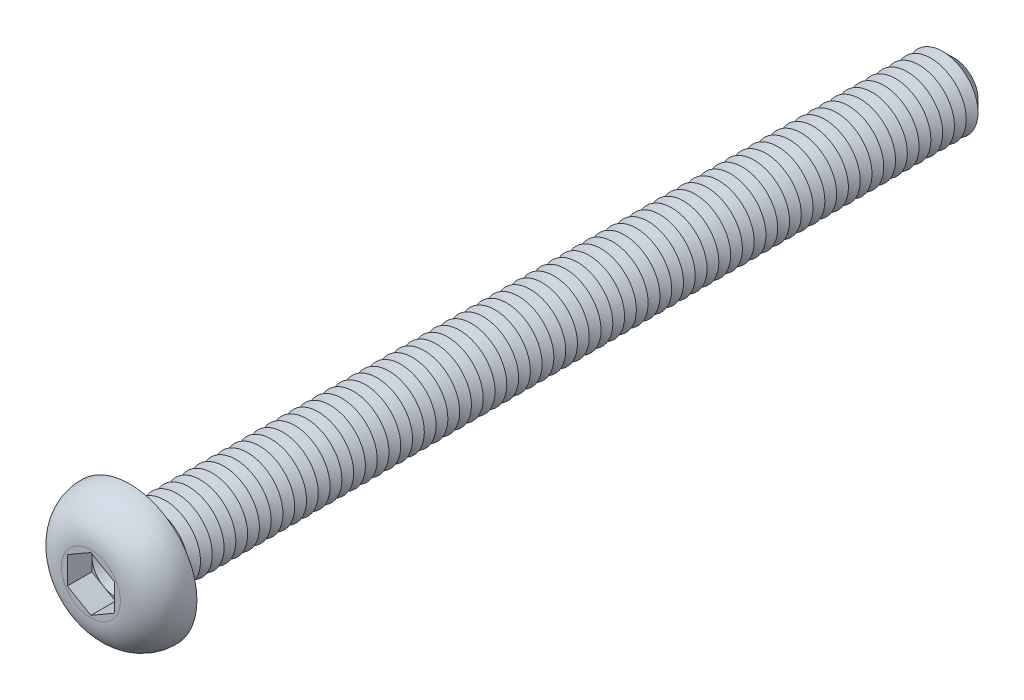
SolidWorks part; units mm, degrees
ref_plane "Front Plane" through (0, 0, 0) normal (0, 0, 1) x (1, 0, 0)
ref_plane "Top Plane" through (0, 0, 0) normal (0, 1, 0) x (1, 0, 0)
ref_plane "Right Plane" through (0, 0, 0) normal (1, 0, 0) x (0, 0, -1)
sketch "Sketch1" plane through (0, 0, 0) normal (1, 0, 0) x (0, 0, -1)
  line L0 (-47.9342, 0) -> (60.3146, 0) construction
sketch "Sketch2" plane through (0, 0, 0) normal (1, 0, 0) x (0, 0, -1)
  line L0 (0, 0) -> (-1.65, 0)
  line L1 (-47.9342, 0) -> (60.3146, 0) construction
  line L2 (-1.65, 0) -> (-1.65, 1.2508)
  line L3 (0, 2.85) -> (0, 0)
  arc A0 (-1.65, 1.2508) -> (0, 2.85) centre (-0.05, 1.2508) cw
  dimension "D1" = 1.6
  dimension "D2" = 1.65
  dimension "D3" = 2.85
revolve "Revolve1" add sketch "Sketch2" angle 360 about L0
sketch "Sketch3" plane through (0, 0, 1.65) normal (0, 0, 1) x (1, 0, 0)
  line L1 (0, 1.1547) -> (-1, 0.5774)
  line L2 (-1, 0.5774) -> (-1, -0.5774)
  line L3 (-1, -0.5774) -> (0, -1.1547)
  line L4 (0, -1.1547) -> (1, -0.5774)
  line L5 (1, -0.5774) -> (1, 0.5774)
  line L6 (1, 0.5774) -> (0, 1.1547)
  circle A0 centre (0, 0) radius 1 construction
  dimension "D1" = 2
extrude "Cut-Extrude1" cut sketch "Sketch3" against normal blind 1.04
sketch "Sketch4" plane through (0, 0, 0) normal (0, 0, -1) x (-1, 0, 0)
  circle A0 centre (0, 0) radius 1.5
  dimension "D1" = 3
extrude "Boss-Extrude1" add sketch "Sketch4" along normal blind 35
chamfer "Chamfer1" distance 0.5 angle 45 1 edges at (-1.5, 0, -35)
sketch "Sketch5" plane through (0, 0, 0) normal (1, 0, 0) x (0, 0, -1)
  line L0 (0.5, 1.5) -> (1, 1.5)
  line L1 (34.5, 1.5) -> (0, 1.5) construction
  line L2 (1, 1.5) -> (0.75, 1.067)
  line L3 (0.75, 1.067) -> (0.5, 1.5)
  line L4 (0, -2.85) -> (0, 2.85) construction
  line L5 (34.5, 1.5) -> (0, 1.5) construction
  dimension "D1" = 0.5
  dimension "D2" = 0.5
revolve "Cut-Revolve1" cut sketch "Sketch5" angle 360 about L0
pattern_linear "LPattern1" count 68 spacing 0.5 along (0, 0, -1) of "Cut-Revolve1"
fillet "Fillet2" radius 0.2 1 edges at (1.5, 0, 0)
sketch "Sketch6" plane through (0, 0, 0.61) normal (0, 0, 1) x (1, 0, 0)
  line L0 (0, -1.1547) -> (1, -0.5774) construction
  circle A0 centre (0, 0) radius 1
extrude "Cut-Extrude2" cut sketch "Sketch6" against normal through all draft 60
